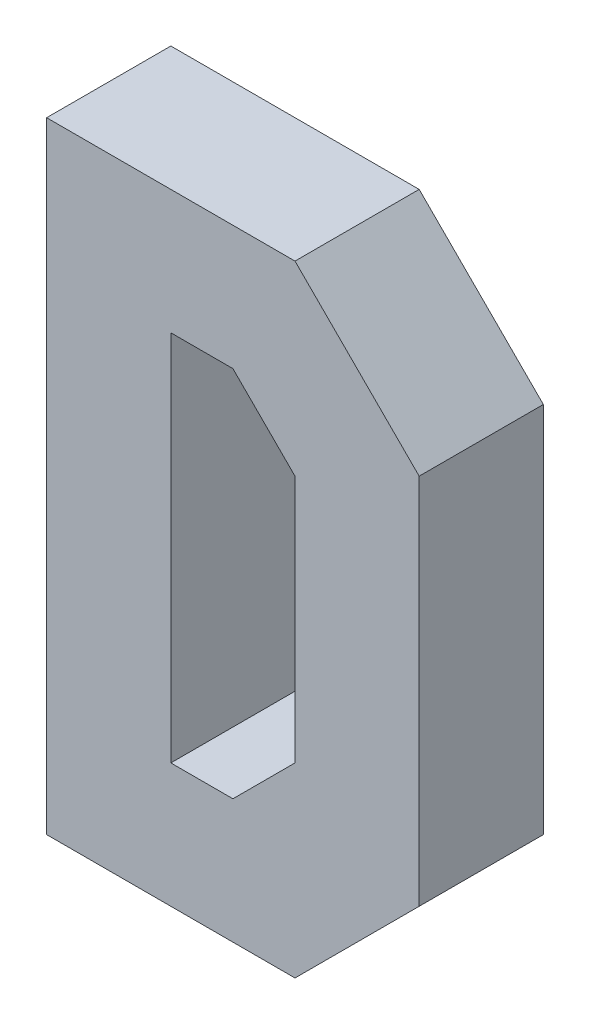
SolidWorks part; units mm, degrees
ref_plane "Plan de face" through (0, 0, 0) normal (0, 0, 1) x (1, 0, 0)
ref_plane "Plan de dessus" through (0, 0, 0) normal (0, 1, 0) x (1, 0, 0)
ref_plane "Plan de droite" through (0, 0, 0) normal (1, 0, 0) x (0, 0, -1)
sketch "Esquisse1" plane through (0, 0, 0) normal (0, 0, 1) x (1, 0, 0)
  line L1 (0, 0) -> (30, 0)
  line L2 (0, 0) -> (0, 50)
  line L3 (0, 50) -> (30, 50)
  line L4 (30, 0) -> (30, 50)
  line L5 (10, 40) -> (20, 40)
  line L6 (10, 40) -> (10, 10)
  line L7 (10, 10) -> (20, 10)
  line L8 (20, 40) -> (20, 10)
  dimension "D1" = 30
  dimension "D2" = 50
  dimension "D3" = 10
  dimension "D4" = 10
  dimension "D5" = 10
  dimension "D6" = 10
extrude "Boss.-Extru.1" add sketch "Esquisse1" along normal blind 10
chamfer "Chanfrein1" distance 10 angle 45 2 edges at (30, 0, 5) (30, 50, 5)
chamfer "Chanfrein2" distance 5 angle 45 2 edges at (20, 10, 5) (20, 40, 5)
